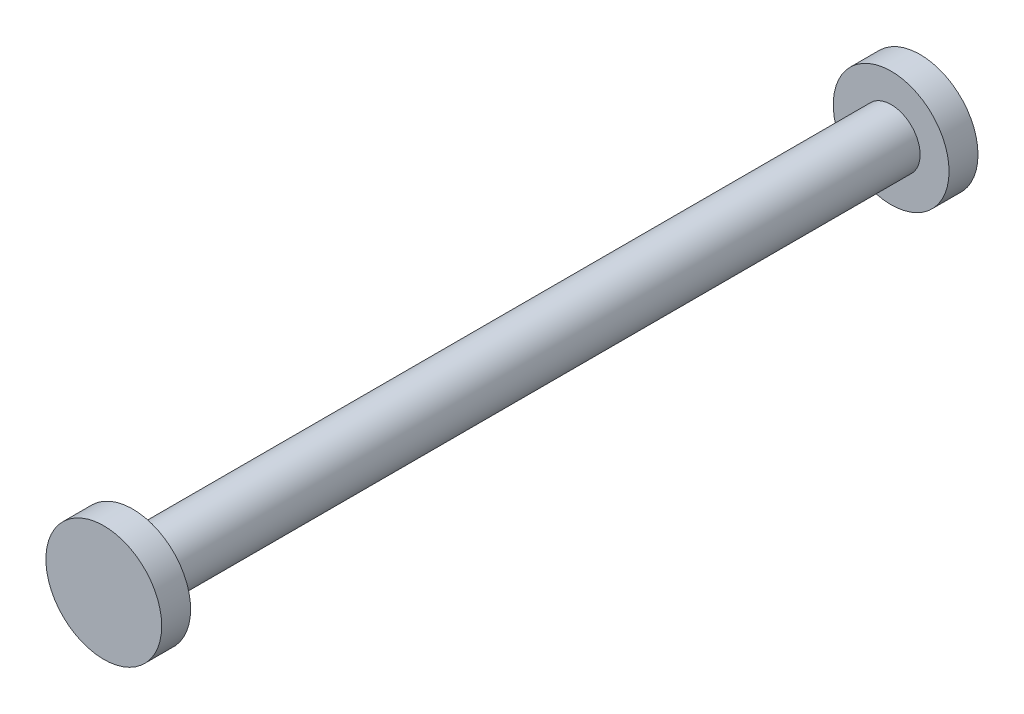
SolidWorks part; units mm, degrees
ref_plane "Front Plane" through (0, 0, 0) normal (0, 0, 1) x (1, 0, 0)
ref_plane "Top Plane" through (0, 0, 0) normal (0, 1, 0) x (1, 0, 0)
ref_plane "Right Plane" through (0, 0, 0) normal (1, 0, 0) x (0, 0, -1)
sketch "Sketch1" plane through (0, 0, 0) normal (0, 0, 1) x (1, 0, 0)
  circle A0 centre (0, 0) radius 10
extrude "Boss-Extrude1" add sketch "Sketch1" along normal blind 5
sketch "Sketch2" plane through (0, 0, 5) normal (0, 0, 1) x (1, 0, 0)
  circle A0 centre (0, 0) radius 5
extrude "Boss-Extrude2" add sketch "Sketch2" along normal blind 131
sketch "Sketch3" plane through (0, 0, 136) normal (0, 0, 1) x (1, 0, 0)
  circle A0 centre (0, 0) radius 10
extrude "Boss-Extrude3" add sketch "Sketch3" along normal blind 5
